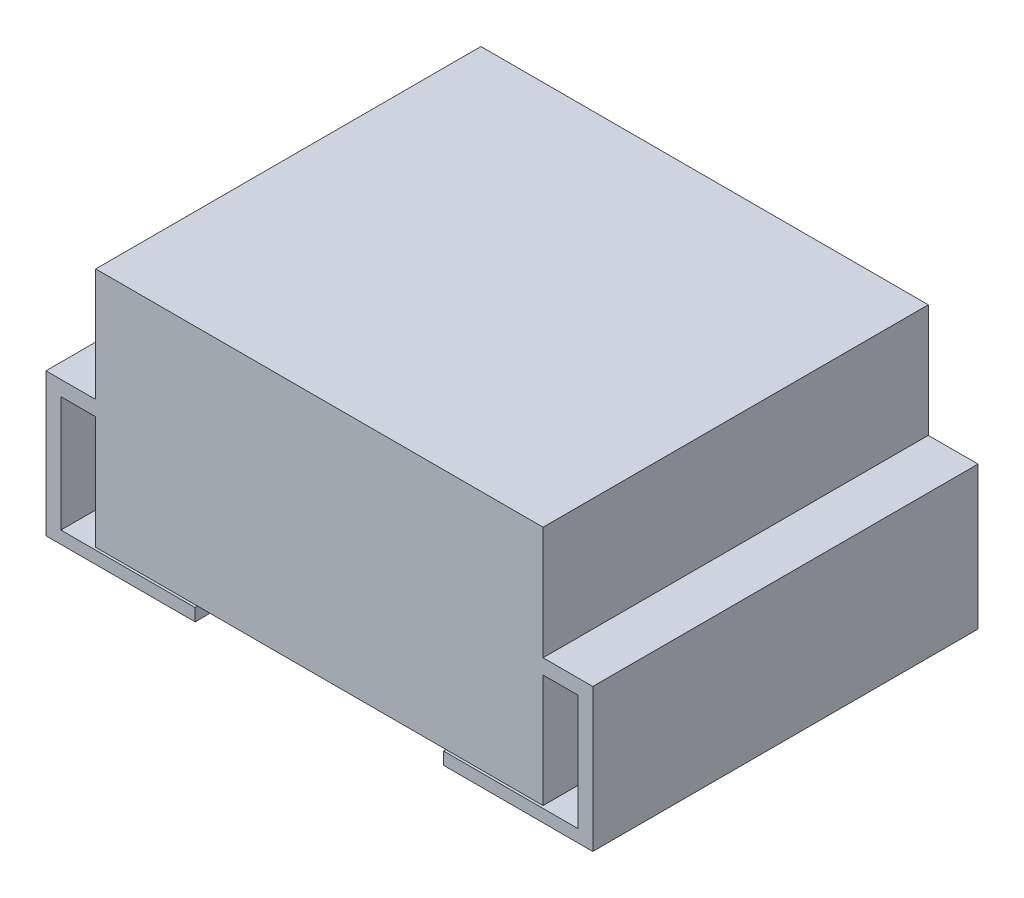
SolidWorks part; units mm, degrees
ref_plane "Front Plane" through (0, 0, 0) normal (0, 0, 1) x (1, 0, 0)
ref_plane "Top Plane" through (0, 0, 0) normal (0, 1, 0) x (1, 0, 0)
ref_plane "Right Plane" through (0, 0, 0) normal (1, 0, 0) x (0, 0, -1)
sketch "Sketch1" plane through (0, 0, 0) normal (0, 1, 0) x (1, 0, 0)
  line L1 (-2.286, 1.9685) -> (2.286, 1.9685)
  line L2 (-2.286, 1.9685) -> (-2.286, -1.9685)
  line L3 (-2.286, -1.9685) -> (2.286, -1.9685)
  line L4 (2.286, 1.9685) -> (2.286, -1.9685)
  line L5 (-2.286, 1.9685) -> (2.286, -1.9685) construction
  line L6 (-2.286, -1.9685) -> (2.286, 1.9685) construction
  point P0 (0, 0)
extrude "Boss-Extrude1" add sketch "Sketch1" along normal blind 2.4638
sketch "Sketch2" plane through (-2.286, 0, 0) normal (-1, 0, 0) x (0, 0, 1)
  line L2 (1.9685, 2.4638) -> (1.9685, 0) construction
  line L4 (-1.9685, 1.1557) -> (1.9685, 1.1557)
  line L5 (-1.9685, 1.1557) -> (-1.9685, 1.3081)
  line L6 (-1.9685, 1.3081) -> (1.9685, 1.3081)
  line L7 (1.9685, 1.1557) -> (1.9685, 1.3081)
  line L8 (-1.9685, 1.1557) -> (1.9685, 1.3081) construction
  line L9 (-1.9685, 1.3081) -> (1.9685, 1.1557) construction
  point P6 (0, 1.2319)
extrude "Boss-Extrude2" add sketch "Sketch2" along normal blind 0.3556
sketch "Sketch3" plane through (-2.6416, 0, 0) normal (-1, 0, 0) x (0, 0, 1)
  line L0 (-1.9685, 1.3081) -> (1.9685, 1.3081)
  line L1 (1.9685, 1.3081) -> (1.9685, -0.1524)
  line L2 (1.9685, -0.1524) -> (-1.9685, -0.1524)
  line L3 (-1.9685, -0.1524) -> (-1.9685, 1.3081)
extrude "Boss-Extrude3" add sketch "Sketch3" along normal blind 0.1524
sketch "Sketch4" plane through (0, 0, 1.9685) normal (0, 0, 1) x (1, 0, 0)
  line L0 (-2.6416, -0.1524) -> (-1.27, -0.1524)
  line L6 (-1.27, -0.1524) -> (-1.27, -0.0254)
  line L7 (-1.27, -0.0254) -> (-2.6416, -0.0254)
  line L8 (-2.6416, -0.1524) -> (-2.6416, 1.1557) construction
  line L9 (-2.6416, -0.0254) -> (-2.6416, -0.1524)
extrude "Boss-Extrude4" add sketch "Sketch4" against normal blind 3.937
sketch "Sketch5" plane through (2.286, 0, 0) normal (1, 0, 0) x (0, 0, -1)
  line L2 (1.9685, 2.4638) -> (1.9685, 0) construction
  line L4 (-1.9685, 1.1557) -> (1.9685, 1.1557)
  line L5 (-1.9685, 1.1557) -> (-1.9685, 1.3081)
  line L6 (-1.9685, 1.3081) -> (1.9685, 1.3081)
  line L7 (1.9685, 1.1557) -> (1.9685, 1.3081)
  line L8 (-1.9685, 1.1557) -> (1.9685, 1.3081) construction
  line L9 (-1.9685, 1.3081) -> (1.9685, 1.1557) construction
  point P6 (0, 1.2319)
extrude "Boss-Extrude5" add sketch "Sketch5" along normal blind 0.3556
sketch "Sketch7" plane through (2.6416, 0, 0) normal (1, 0, 0) x (0, 0, -1)
  line L0 (1.9685, 1.3081) -> (1.9685, -0.1524)
  line L1 (1.9685, -0.1524) -> (-1.9685, -0.1524)
  line L2 (-1.9685, -0.1524) -> (-1.9685, 1.3081)
  line L3 (-1.9685, 1.3081) -> (-1.9685, 1.1557) construction
  line L4 (1.9685, 1.3081) -> (-1.9685, 1.3081) construction
  line L5 (-1.9685, 1.3081) -> (1.9685, 1.3081)
extrude "Boss-Extrude6" add sketch "Sketch7" along normal blind 0.1524
sketch "Sketch10" plane through (0, 0, 1.9685) normal (0, 0, 1) x (1, 0, 0)
  line L0 (2.6416, -0.1524) -> (1.27, -0.1524)
  line L1 (1.27, -0.1524) -> (1.27, -0.0254)
  line L2 (1.27, -0.0254) -> (2.6416, -0.0254)
  line L3 (2.6416, 1.1557) -> (2.6416, -0.1524) construction
  line L4 (2.6416, -0.0254) -> (2.6416, -0.1524)
extrude "Boss-Extrude7" add sketch "Sketch10" against normal blind 3.937
